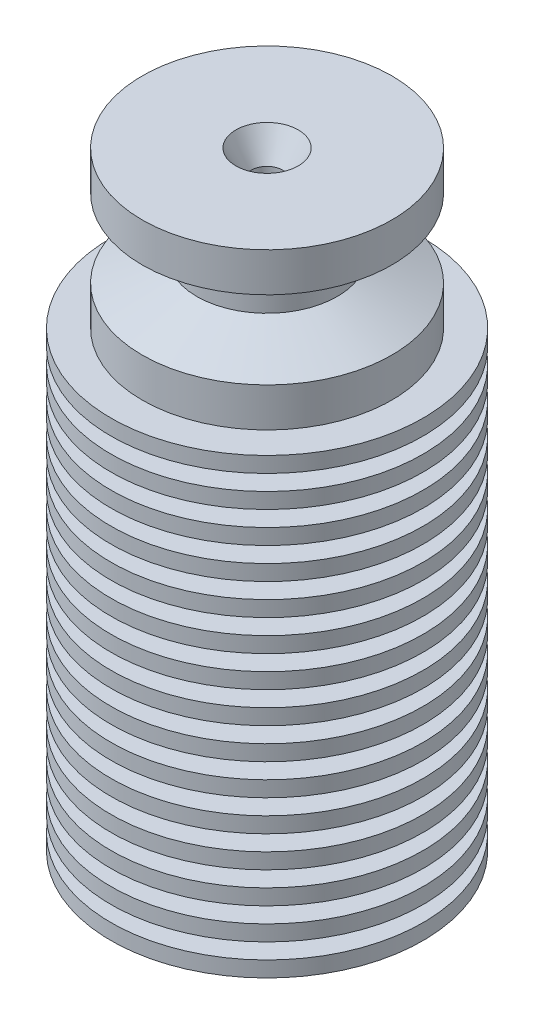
SolidWorks part; units mm, degrees
ref_plane "Plan de face" through (0, 0, 0) normal (0, 0, 1) x (1, 0, 0)
ref_plane "Plan de dessus" through (0, 0, 0) normal (0, 1, 0) x (1, 0, 0)
ref_plane "Plan de droite" through (0, 0, 0) normal (1, 0, 0) x (0, 0, -1)
sketch "Esquisse2" plane through (0, 0, 0) normal (0, 0, 1) x (1, 0, 0)
  line L0 (-1, 0) -> (-1, -44)
  line L1 (-1, -44) -> (-3, -44)
  line L2 (-3, -44) -> (-3, -40)
  line L3 (-3, -40) -> (-2, -40)
  line L4 (-2, -40) -> (-2, -10)
  line L5 (-2, -10) -> (-8, -10)
  line L6 (-8, -10) -> (-8, -7.5)
  line L7 (-8, -7.5) -> (-4.5, -6)
  line L8 (-4.5, -6) -> (-4.5, -4)
  line L9 (-4.5, -4) -> (-8, -2.5)
  line L10 (-8, -2.5) -> (-8, 0)
  line L11 (-8, 0) -> (-1, 0)
  line L12 (0, 9.1912) -> (0, -49.7372) construction
  point P1 (-1, -45)
  point P15 (-1, -45.3028)
  point P16 (0, -49.7372)
  dimension "D1" = 16
  dimension "D2" = 10
  dimension "D3" = 34
  dimension "D4" = 4
  dimension "D5" = 2
  dimension "D7" = 6
  dimension "D8" = 4
  dimension "D10" = 2.5
  dimension "D11" = 5
  dimension "D12" = 2
  dimension "D13" = 3.5
revolve "Révolution1" add sketch "Esquisse2" angle 360 about L12
sketch "Esquisse3" plane through (0, -10, 0) normal (0, -1, 0) x (1, 0, 0)
  circle A0 centre (0, 0) radius 2
  circle A1 centre (0, 0) radius 10
  circle A2 centre (0, 0) radius 2 construction
  dimension "D1" = 20
extrude "Boss.-Extru.1" add sketch "Esquisse3" along normal blind 1
pattern_linear "Répétition linéaire1" count 15 spacing 2 along (0, -1, 0) of "Boss.-Extru.1"
chamfer "Chanfrein1" distance 1 angle 60 1 edges at (0, 0, 1)
chamfer "Chanfrein3" distance 0.5 angle 45 2 edges at (0, -40, 3) (0, -44, 3)
